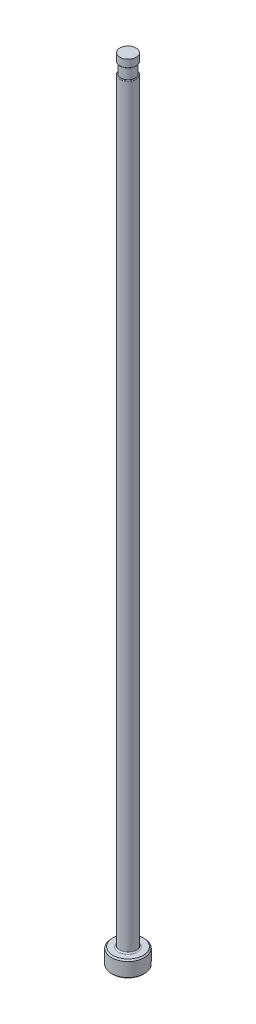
SolidWorks part; units mm, degrees
ref_plane "Front Plane" through (0, 0, 0) normal (0, 0, 1) x (1, 0, 0)
ref_plane "Top Plane" through (0, 0, 0) normal (0, 1, 0) x (1, 0, 0)
ref_plane "Right Plane" through (0, 0, 0) normal (1, 0, 0) x (0, 0, -1)
other "Configuration Table"
sketch "Sketch1" plane through (0, 0, 0) normal (0, 0, 1) x (1, 0, 0)
  line L0 (0, 259.9588) -> (0, -15.1925) construction
  line L1 (0, 0) -> (-3.175, 0)
  line L2 (-3.175, 0) -> (-3.175, 3.175)
  line L3 (-3.175, 3.175) -> (-1.5875, 3.175)
  line L4 (-1.5875, 3.175) -> (-1.5875, 152.4)
  line L5 (-1.5875, 152.4) -> (0, 152.4)
  line L6 (0, 152.4) -> (0, 0)
  dimension "L" = 152.4
  dimension "H" = 6.35
  dimension "T" = 3.175
  dimension "D" = 3.175
revolve "Revolve1" add sketch "Sketch1" angle 360 about L0
chamfer "Chamfer1" distance 0.254 angle 45 2 edges at (0, 3.175, 3.175) (0, 0, 3.175)
fillet "Fillet1" radius 0.254 1 edges at (0, 3.175, 1.5875)
sketch "Sketch2" plane through (0, 0, 0) normal (0, 0, 1) x (1, 0, 0)
  line L0 (-1.5875, 152.4) -> (-1.5875, 3.429) construction
  line L1 (-1.5875, 150.876) -> (-1.3843, 150.876)
  line L2 (-1.5875, 150.876) -> (-1.5875, 148.844)
  line L3 (-1.5875, 148.844) -> (-1.3843, 148.844)
  line L4 (-1.3843, 150.876) -> (-1.3843, 148.844)
  line L5 (1.5875, 152.4) -> (-1.5875, 152.4) construction
  line L6 (0, 153.4483) -> (0, 147.3282) construction
  dimension "D1" = 2.032
  dimension "N" = 1.524
  dimension "FD" = 0.2032
  dimension "D3" = 2.7686
revolve "Vent Relief" cut sketch "Sketch2" angle 360 about L6
sketch "Sketch3" plane through (0, 0, 0) normal (0, 0, 1) x (1, 0, 0)
  line L0 (-1.3843, 149.86) -> (-1.3843, 86.36)
  line L1 (-1.3843, 150.876) -> (-1.3843, 148.844) construction
  line L2 (-1.5875, 148.844) -> (-1.5875, 3.429) construction
  line L3 (-1.5875, 85.2424) -> (-1.5875, 149.86)
  line L4 (-1.5875, 149.86) -> (-1.3843, 149.86)
  arc A0 (-1.3843, 86.36) -> (-1.5875, 85.2424) centre (-4.5593, 86.36) cw
  dimension "D1" = 3.175
  dimension "D2" = 63.5
extrude "D-Slot" cut sketch "Sketch3" against normal through all both and the other way through all
sketch "Sketch5" plane through (0, 0, 0) normal (0, 0, 1) x (1, 0, 0)
  line L0 (-1.5875, 150.876) -> (1.5875, 150.876) construction
  line L1 (-1.5875, 152.4) -> (-1.5621, 152.4)
  line L2 (-1.5875, 152.4) -> (-1.5875, 150.876)
  line L3 (-1.5875, 150.876) -> (-1.5621, 150.876)
  line L4 (-1.5621, 152.4) -> (-1.5621, 150.876)
  line L5 (0, 152.6877) -> (0, 150.5771) construction
  dimension "VP" = 0.0254
revolve "Vent Diameter" cut sketch "Sketch5" angle 360 about L5
fillet "Fillet2" radius 0.127 2 edges at (1.5875, 148.844, 0) (0, 150.876, 1.5621)
sketch "Pocket Sketch" plane through (0, 0, 0) normal (0, 0, 1) x (1, 0, 0)
  line L0 (-3.5719, 0) -> (-3.5719, 3.2004)
  line L1 (-3.5719, 3.2004) -> (-2.5479, 3.2004)
  line L2 (-1.7859, 3.9624) -> (-1.7859, 22.225)
  line L3 (-1.7859, 22.225) -> (0, 22.225)
  line L4 (0, 22.225) -> (0, 0)
  line L5 (0, 0) -> (-3.5719, 0)
  line L6 (0, 12.6104) -> (0, -2.4989) construction
  line L7 (-3.175, 2.921) -> (-3.175, 0.254) construction
  line L8 (2.921, 3.175) -> (-2.921, 3.175) construction
  line L9 (-1.5875, 85.2424) -> (-1.5875, 3.429) construction
  line L10 (-2.5479, 3.2004) -> (-1.7859, 3.9624)
  point P3 (-1.7859, 3.2004)
  dimension "D1" = 7.1437
  dimension "D2" = 0.3969
  dimension "D3" = 0.0254
  dimension "D4" = 0.1984
  dimension "D5" = 3.5719
  dimension "D6" = 22.225
